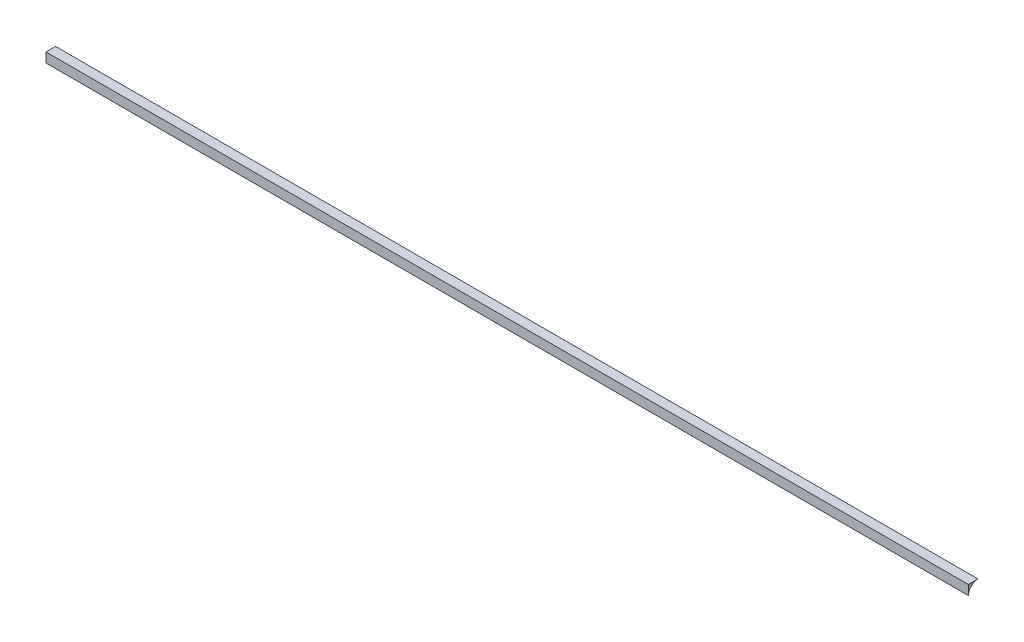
SolidWorks part; units mm, degrees
ref_plane "Front Plane" through (0, 0, 0) normal (1, 0, 0) x (0, 1, 0)
ref_plane "Top Plane" through (0, 0, 0) normal (0, 0, 1) x (0, 1, 0)
ref_plane "Right Plane" through (0, 0, 0) normal (0, 1, 0) x (-1, 0, 0)
sketch "Sketch1" plane through (0, 0, 0) normal (1, 0, 0) x (0, 1, 0)
  line L0 (152.4, 152.4) -> (149.225, 152.4)
  line L1 (149.225, 152.4) -> (149.8444, 152.339)
  line L2 (149.8444, 152.339) -> (150.44, 152.1583)
  line L3 (150.44, 152.1583) -> (150.9889, 151.8649)
  line L4 (150.9889, 151.8649) -> (151.4701, 151.4701)
  line L5 (151.4701, 151.4701) -> (151.8649, 150.9889)
  line L6 (151.8649, 150.9889) -> (152.1583, 150.44)
  line L7 (152.1583, 150.44) -> (152.339, 149.8444)
  line L8 (152.339, 149.8444) -> (152.4, 149.225)
  line L9 (152.4, 149.225) -> (152.4, 152.4)
extrude "Applied_corner_caulk" add sketch "Sketch1" along normal blind 304.8
